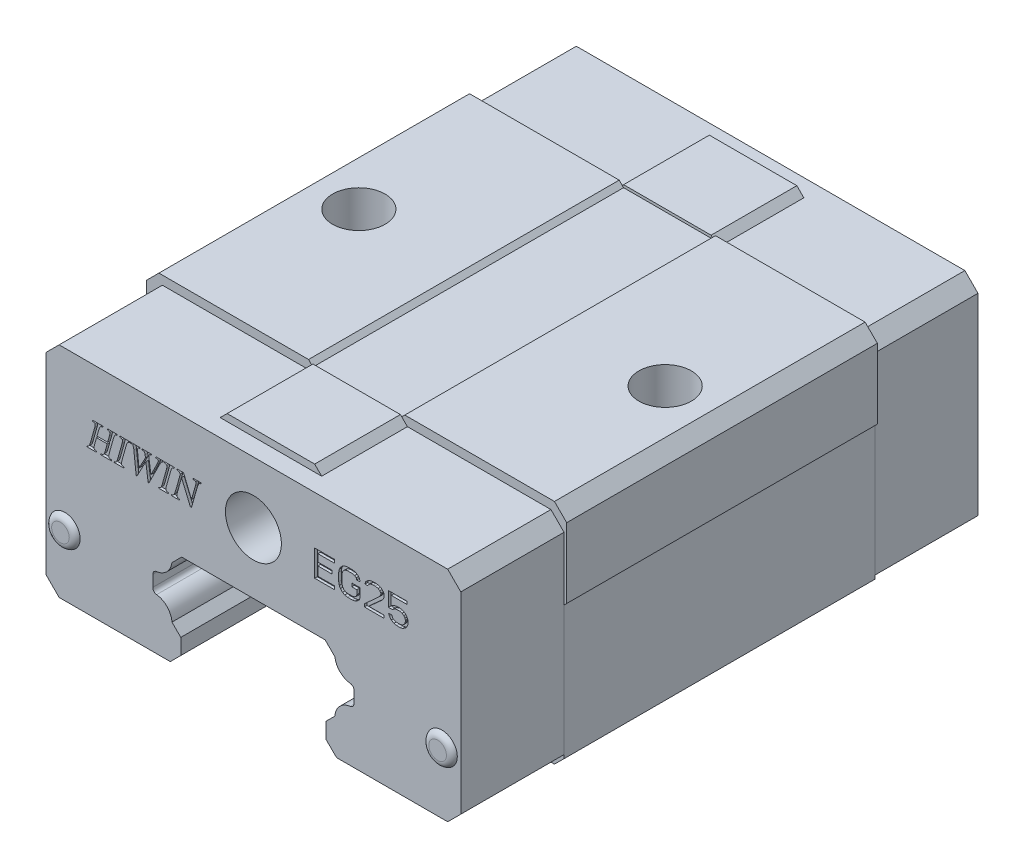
SolidWorks part; units mm, degrees
ref_plane "前视基准面" through (0, 0, 0) normal (0, 0, 1) x (1, 0, 0)
ref_plane "上视基准面" through (0, 0, 0) normal (0, 1, 0) x (1, 0, 0)
ref_plane "右视基准面" through (0, 0, 0) normal (1, 0, 0) x (0, 0, -1)
imported_body "输入1"
sketch "草图1" plane through (0, 0, 11.8) normal (0, 0, 1) x (1, 0, 0)
  line L0 (10.2071, -11) -> (22.2, -11) construction
  line L1 (-14, 3.3) -> (14, 3.3)
  line L2 (-14, 3.3) -> (-14, -11)
  line L3 (-14, -11) -> (14, -11)
  line L4 (14, 3.3) -> (14, -11)
  line L5 (11, 3.3) -> (-11, 3.3) construction
  line L6 (14, -6) -> (14, -2) construction
  line L7 (-14, -2) -> (-14, -6) construction
extrude "凸台-拉伸1" add sketch "草图1" against normal up to surface (59.1 mm away)
sketch "草图2" plane through (0, 0, 11.8) normal (0, 0, 1) x (1, 0, 0)
  line L0 (0, 0) -> (0, -18) construction
  line L1 (-22.6, 15) -> (22.6, 15) construction
  line L23 (8.3, -8) -> (9.305, -6.995)
  line L24 (-8.196, 0) -> (-9.3139, -1.1179)
  line L25 (-11.5, -3.3646) -> (-11.5, -4.654)
  line L26 (10.3, -18) -> (11.5, -16.8)
  line L27 (8.3, -9.8) -> (8.3, -8)
  line L28 (-11.5, -13) -> (-11.5, -16.8)
  line L29 (3, -18) -> (10.3, -18)
  line L30 (11.5, -16.8) -> (11.5, -13)
  line L31 (-11.5, -16.8) -> (-10.3, -18)
  line L32 (-3, -18) -> (-2.5, -17.5)
  line L33 (11.5, -13) -> (8.3, -9.8)
  line L34 (9.3139, -1.1179) -> (8.196, 0)
  line L35 (2.5, -17.5) -> (3, -18)
  line L36 (-3, -18) -> (3, -18) construction
  line L37 (8.196, 0) -> (-8.196, 0)
  line L38 (-8.3, -9.8) -> (-11.5, -13)
  line L39 (-8.3, -8) -> (-8.3, -9.8)
  line L40 (-2.5, -17.5) -> (2.5, -17.5)
  line L41 (11.5, -4.654) -> (11.5, -3.3646)
  line L42 (-9.305, -6.995) -> (-8.3, -8)
  line L43 (-10.3, -18) -> (-3, -18)
  arc A8 (-11.06, -2.8682) -> (-9.3139, -1.1179) centre (-11.3, -0.8827) ccw
  arc A9 (9.3139, -1.1179) -> (11.06, -2.8682) centre (11.3, -0.8827) ccw
  arc A10 (11.06, -5.1504) -> (9.305, -6.995) centre (11.3, -7.136) ccw
  arc A11 (11.06, -5.1504) -> (11.5, -4.654) centre (11, -4.654) ccw
  arc A12 (-9.305, -6.995) -> (-11.06, -5.1504) centre (-11.3, -7.136) ccw
  arc A13 (-11.5, -4.654) -> (-11.06, -5.1504) centre (-11, -4.654) ccw
  arc A14 (-11.06, -2.8682) -> (-11.5, -3.3646) centre (-11, -3.3646) ccw
  arc A15 (11.5, -3.3646) -> (11.06, -2.8682) centre (11, -3.3646) ccw
  dimension "D1" = 33
extrude "切除-拉伸1" cut sketch "草图2" against normal through all
sketch "草图3" plane through (0, 0, 0) normal (0, 0, 1) x (1, 0, 0)
  line L0 (23.7, 5.3) -> (24, 5.6) construction
  line L1 (23.7, -9.9) -> (23.71, -9.9)
  line L2 (23.7, -9.9) -> (23.7, 5.31)
  line L3 (23.7, 5.31) -> (23.71, 5.31)
  line L4 (23.71, -9.9) -> (23.71, 5.31)
  dimension "D1" = 0.01
extrude "凸台-拉伸2" add sketch "草图3" against normal up to surface (35.5 mm away)
sketch "草图4" plane through (0, 0, 0) normal (0, 0, 1) x (1, 0, 0)
  line L0 (0, 0) -> (0, 15) construction
  line L1 (8.196, 0) -> (-8.196, 0) construction
  line L2 (-22.6, 15) -> (22.6, 15) construction
  line L4 (-5, 15) -> (5, 15)
  line L5 (-5, 15) -> (-5, 14.5)
  line L6 (-5, 14.5) -> (5, 14.5)
  line L7 (5, 15) -> (5, 14.5)
  dimension "D1" = 0.5
extrude "切除-拉伸2" cut sketch "草图4" against normal up to surface (35.5 mm away)
chamfer "倒角1" distance 0.5 angle 45 2 edges at (5, 15, -17.75) (-5, 15, -17.75)
